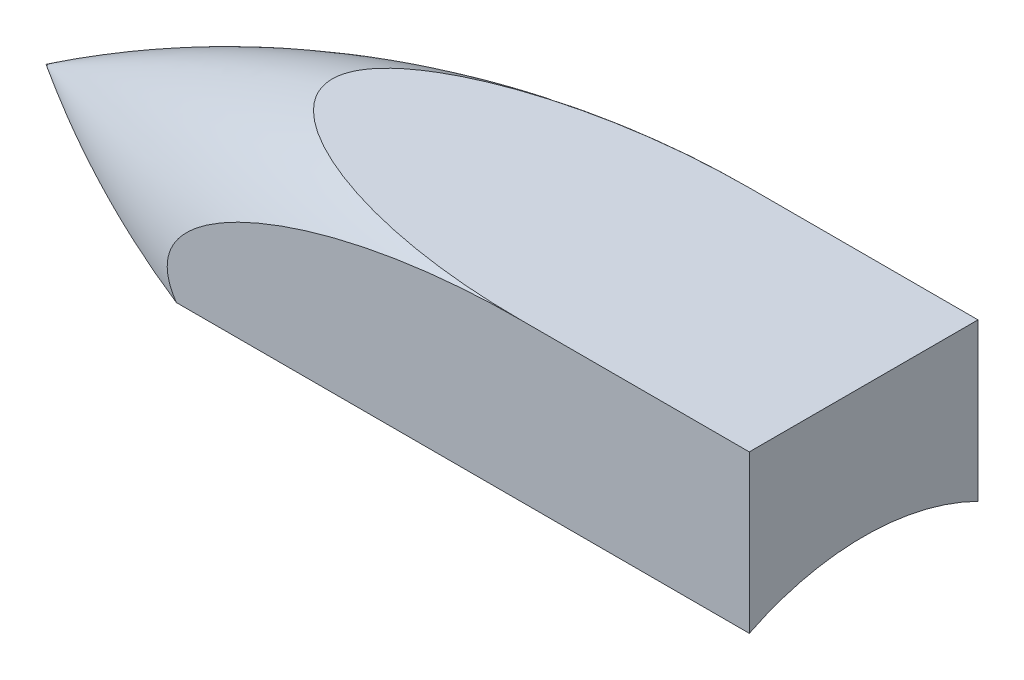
SolidWorks part; units mm, degrees
ref_plane "Front" through (0, 0, 0) normal (0, 0, 1) x (1, 0, 0)
ref_plane "Top" through (0, 0, 0) normal (0, 1, 0) x (1, 0, 0)
ref_plane "Right" through (0, 0, 0) normal (1, 0, 0) x (0, 0, -1)
sketch "Sketch1" plane through (0, 0, 0) normal (1, 0, 0) x (0, 0, -1)
  line L1 (0, 0) -> (0, 14.478) construction
  line L2 (12.7, 14.478) -> (-12.7, 14.478) construction
  circle A0 centre (0, 0) radius 19.2588
  dimension "D1" = 25.4
  dimension "D2" = 14.478
extrude "Extrude1" add sketch "Sketch1" along normal blind 25.4
sketch "Sketch7" plane through (0, 0, 0) normal (0, 0, 1) x (1, 0, 0)
  line L0 (0, 0) -> (0, 19.2588) construction
  line L1 (0, 0) -> (-65.4095, 0) construction
  line L2 (0, 0) -> (0, 19.2588)
  line L3 (0, 0) -> (-65.4095, 0)
  arc A0 (0, 19.2588) -> (-65.4095, 0) centre (0, -101.4469) ccw
revolve "Revolve3" add sketch "Sketch7" angle 360 about L3
sketch "Sketch8" plane through (25.4, 0, 0) normal (1, 0, 0) x (0, 0, -1)
  line L0 (-12.7, 14.478) -> (12.7, 14.478) construction
  line L1 (-12.7, 14.478) -> (-12.7, -2.9773)
  line L2 (0, 0) -> (0, -28.575) construction
  line L3 (12.7, 14.478) -> (12.7, -2.9773)
  line L5 (12.7, 14.478) -> (-12.7, 14.478)
  line L6 (12.7, 14.478) -> (12.7, 19.3492)
  line L7 (12.7, 19.3492) -> (-12.7, 19.3492)
  line L8 (-12.7, 14.478) -> (-12.7, 19.3492)
  circle A0 centre (0, 0) radius 19.2588 construction
  arc A1 (12.7, -2.9773) -> (-12.7, -2.9773) centre (0, -28.575) ccw
  arc A2 (-12.7, 14.478) -> (12.7, 14.478) centre (0, 0) ccw
  dimension "D2" = 28.575
  dimension "D1" = 25.4
extrude "Cut-Extrude1" cut sketch "Sketch8" against normal through all contours L3 A1 L1 M1 | L5 M1
